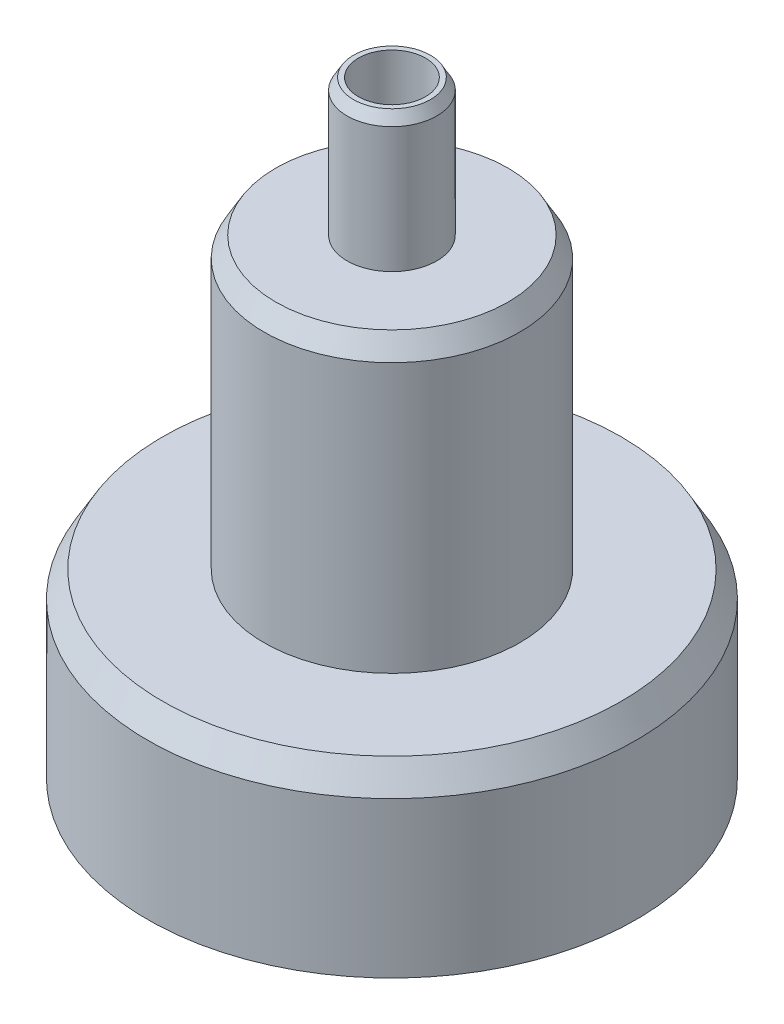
SolidWorks part; units mm, degrees
ref_plane "Front Plane" through (0, 0, 0) normal (0, 0, 1) x (1, 0, 0)
ref_plane "Top Plane" through (0, 0, 0) normal (0, 1, 0) x (1, 0, 0)
ref_plane "Right Plane" through (0, 0, 0) normal (1, 0, 0) x (0, 0, -1)
sketch "Sketch1" plane through (0, 0, 0) normal (0, 0, 1) x (1, 0, 0)
  line L0 (0, 0) -> (0, 71.4664) construction
  line L1 (-34.6, 0) -> (-30.9, 0)
  line L2 (-30.9, 0) -> (-30.9, 2)
  line L3 (-30.9, 12.7) -> (-18.034, 12.7)
  line L4 (-18.034, 12.7) -> (-4.75, 35.2)
  line L5 (-4.75, 35.2) -> (-4.75, 86)
  line L6 (-4.75, 86) -> (-5.4493, 86)
  line L7 (-5.4493, 86) -> (-6.35, 84.44)
  line L8 (-6.35, 84.44) -> (-6.35, 66.66)
  line L9 (-6.35, 66.66) -> (-16.4488, 66.66)
  line L10 (-16.4488, 66.66) -> (-18.1, 63.8)
  line L11 (-18.1, 63.8) -> (-18.1, 25.7)
  line L12 (-18.1, 25.7) -> (-32.4638, 25.7)
  line L13 (-32.4638, 25.7) -> (-34.6, 22)
  line L14 (-34.6, 22) -> (-34.6, 0)
  line L16 (-30.9, 5.0734) -> (-30.9, 12.7)
  line L17 (-30.9, 5.0734) -> (-33.1606, 5.0734)
  line L19 (-30.9, 2) -> (-33.1606, 2)
  line L20 (-33.1606, 5.0734) -> (-33.1606, 2)
revolve "Revolve1" add sketch "Sketch1" angle 360 about L0
equation "\"D12@Sketch1\"=\"D11@Sketch1\""
equation "\"D13@Sketch1\"=\"D11@Sketch1\""
